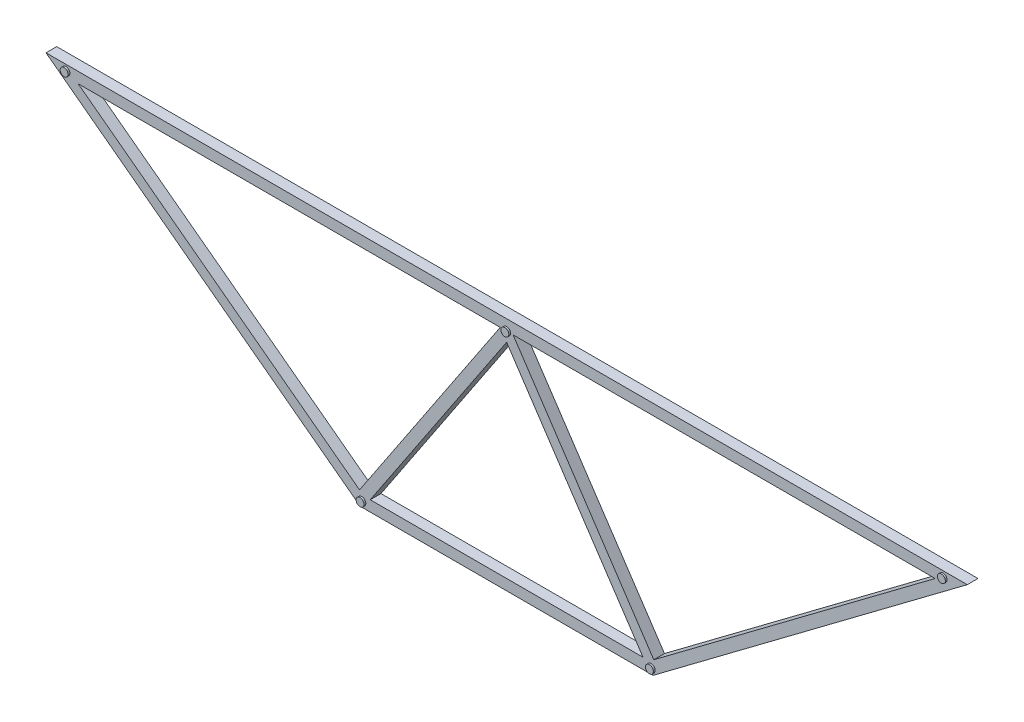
SolidWorks part; units mm, degrees
other "Truss Body"
other "Pin E"
other "Pin A"
other "Pin D"
other "Pin C"
other "Pin B"
ref_plane "Front Plane" through (0, 0, 0) normal (0, 0, 1) x (1, 0, 0)
ref_plane "Top Plane" through (0, 0, 0) normal (0, 1, 0) x (1, 0, 0)
ref_plane "Right Plane" through (0, 0, 0) normal (1, 0, 0) x (0, 0, -1)
sketch "Sketch22" plane through (0, 0, 0) normal (0, 0, 1) x (1, 0, 0)
  line L0 (0, 0) -> (600, 0)
  line L1 (600, 0) -> (1200, 0)
  line L4 (400, -300) -> (800, -300)
  line L5 (-45, 15) -> (600, 15)
  line L6 (0, 0) -> (400, -300)
  line L9 (1200, 0) -> (800, -300)
  line L10 (-45, 15) -> (395, -315)
  line L13 (600, 15) -> (1245, 15)
  line L14 (1245, 15) -> (805, -315)
  line L16 (395, -315) -> (805, -315)
  line L18 (590.9861, 0) -> (393.9907, -295.4931)
  line L19 (600, -13.5208) -> (790.9861, -300)
  line L20 (609.0139, 0) -> (806.0093, -295.4931)
  line L22 (600, -13.5208) -> (409.0139, -300)
extrude "Truss Body." add sketch "Sketch22" along normal blind 15 contours L10 L16 L14 L13 L5 L1 L9 L4 L6 L0 | L22 L19 L4 L9 L20 L1 L0 L18 L6
sketch "Sketch25" plane through (0, 0, 15) normal (0, 0, 1) x (1, 0, 0)
  circle A0 centre (-17.1152, 6.7128) radius 5.555
  circle A1 centre (397.2568, -307.5532) radius 5.555
  circle A2 centre (802.3949, -307.5532) radius 5.555
  circle A3 centre (1211.2073, 6.7128) radius 5.555
  circle A4 centre (600, 0) radius 5.555
  dimension "D1" = 11.11
  dimension "D2" = 11.11
  dimension "D3" = 11.11
  dimension "D4" = 11.11
  dimension "D5" = 11.11
extrude "Pin Holes" cut sketch "Sketch25" against normal through all
sketch "Sketch27" plane through (0, 0, 15) normal (0, 0, 1) x (1, 0, 0)
  circle A0 centre (-17.1152, 6.7128) radius 5.555
  circle A1 centre (397.2568, -307.5532) radius 5.555
  circle A2 centre (802.3949, -307.5532) radius 5.555
  circle A3 centre (600, 0) radius 5.555
  circle A4 centre (1211.2073, 6.7128) radius 5.555
sketch "Sketch29" plane through (0, 0, 15) normal (0, 0, 1) x (1, 0, 0)
  circle A0 centre (-17.1152, 6.7128) radius 5.555
  circle A1 centre (397.2568, -307.5532) radius 5.555
  circle A2 centre (802.3949, -307.5532) radius 5.555
  circle A3 centre (1211.2073, 6.7128) radius 5.555
  circle A4 centre (600, 0) radius 5.555
extrude "Boss-Extrude10" add sketch "Sketch29" against normal blind 17.5 and the other way blind 2.5 separate body
